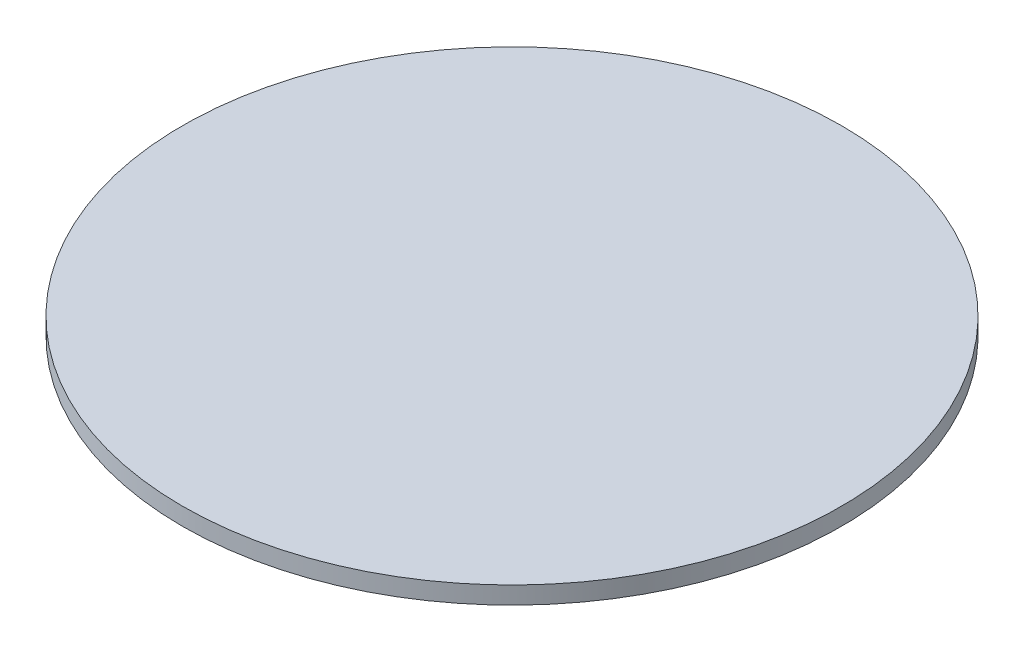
SolidWorks part; units mm, degrees
ref_plane "Front Plane" through (0, 0, 0) normal (0, 0, 1) x (1, 0, 0)
ref_plane "Top Plane" through (0, 0, 0) normal (0, 1, 0) x (1, 0, 0)
ref_plane "Right Plane" through (0, 0, 0) normal (1, 0, 0) x (0, 0, -1)
sketch "Sketch1" plane through (0, 0, 0) normal (0, 1, 0) x (1, 0, 0)
  circle A0 centre (0, 0) radius 75.5
  dimension "D1" = 151
extrude "Boss-Extrude1" add sketch "Sketch1" along normal blind 4
